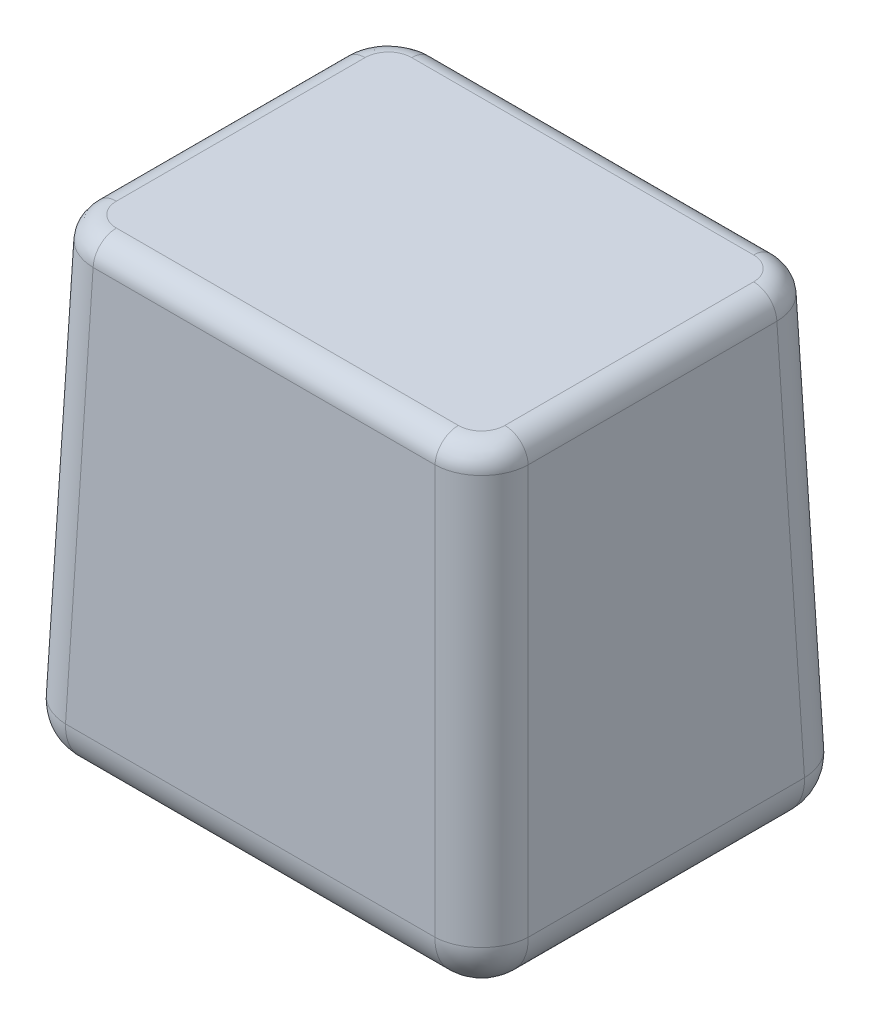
SolidWorks part; units mm, degrees
ref_plane "Front Plane" through (0, 0, 0) normal (0, 0, 1) x (1, 0, 0)
ref_plane "Top Plane" through (0, 0, 0) normal (0, 1, 0) x (1, 0, 0)
ref_plane "Right Plane" through (0, 0, 0) normal (1, 0, 0) x (0, 0, -1)
sketch "Sketch1" plane through (0, 0, 0) normal (0, 1, 0) x (1, 0, 0)
  line L1 (-127, -101.6) -> (127, -101.6)
  line L2 (-127, -101.6) -> (-127, 101.6)
  line L3 (-127, 101.6) -> (127, 101.6)
  line L4 (127, -101.6) -> (127, 101.6)
  line L5 (-127, -101.6) -> (127, 101.6) construction
  line L6 (-127, 101.6) -> (127, -101.6) construction
  point P0 (0, 0)
  dimension "D1" = 203.2
  dimension "D2" = 254
extrude "Boss-Extrude1" add sketch "Sketch1" along normal blind 254 draft 2 contours L1 L4 L3 L2
fillet "Fillet1" radius 25.4 8 edges at (-127, 0, 0) (0, 0, -101.6) (127, 0, 0) (0, 0, 101.6) (-122.5651, 127, 97.1651) (-122.5651, 127, -97.1651) (122.5651, 127, -97.1651) (122.5651, 127, 97.1651)
fillet "Fillet2" radius 12.7 8 edges at (-110.697, 254, -85.297) (0, 254, -92.7301) (110.697, 254, -85.297) (118.1301, 254, 0) (110.697, 254, 85.297) (0, 254, 92.7301) (-110.697, 254, 85.297) (-118.1301, 254, 0)
sketch3d "3DSketch2"
  line L0 (-126.0821, 26.2864, -75.2975) -> (-126.0821, 26.2864, 75.2975) construction
sketch "Sketch4" plane through (-126.0821, 0, 0) normal (-1, 0, 0) x (0, 0, 1)
  circle A3 centre (-11.7975, 122.2962) radius 6.35
  circle A4 centre (-11.7975, 122.2962) radius 10.668
  circle A5 centre (19.8527, 26.67) radius 10.668
  circle A6 centre (19.8527, 26.67) radius 6.35
  dimension "D3" = 12.7
  dimension "D6" = 12.7
  dimension "D7" = 21.336
  dimension "D8" = 21.336
  dimension "D1" = 31.6502
  dimension "D2" = 0.3836
  dimension "D4" = 63.5
  dimension "D5" = 96.0097
extrude "Boss-Extrude2" add sketch "Sketch4" along normal blind 50.8 and the other way up to surface
